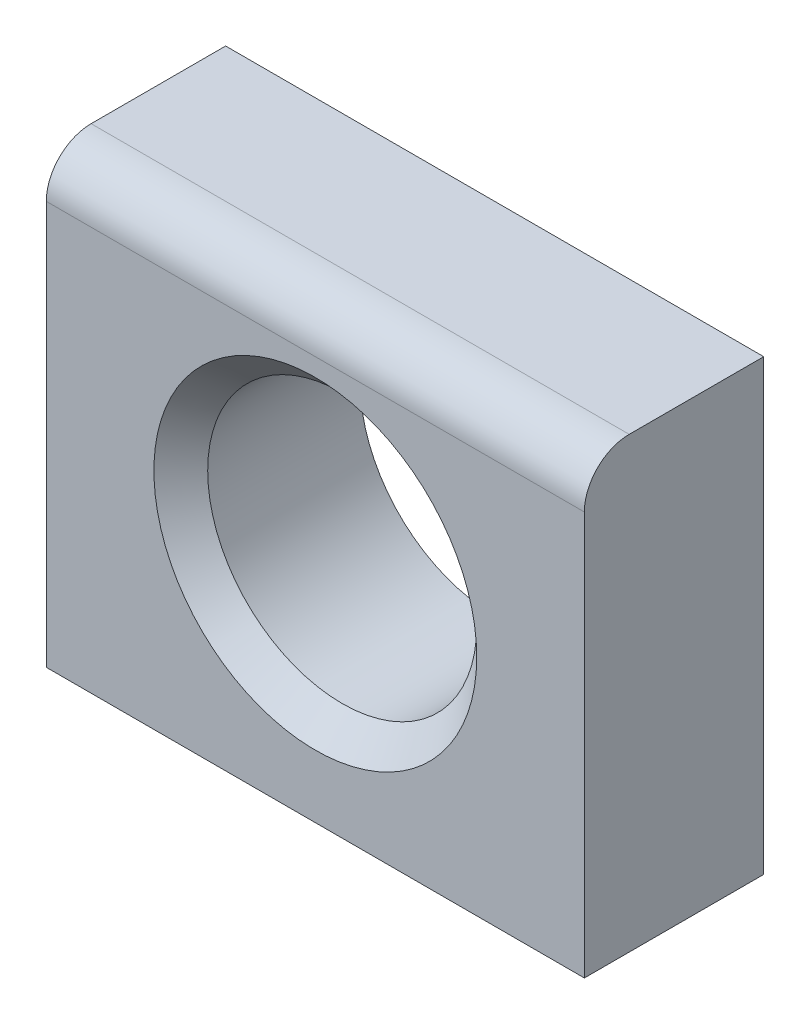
SolidWorks part; units mm, degrees
ref_plane "Płaszczyzna przednia" through (0, 0, 0) normal (0, 0, 1) x (1, 0, 0)
ref_plane "Płaszczyzna górna" through (0, 0, 0) normal (0, 1, 0) x (1, 0, 0)
ref_plane "Płaszczyzna prawa" through (0, 0, 0) normal (1, 0, 0) x (0, 0, -1)
sketch "Szkic1" plane through (0, 0, 0) normal (0, 0, 1) x (1, 0, 0)
  line L1 (30, -25) -> (-30, -25)
  line L2 (30, -25) -> (30, 25)
  line L3 (30, 25) -> (-30, 25)
  line L4 (-30, -25) -> (-30, 25)
  line L5 (30, -25) -> (-30, 25) construction
  line L6 (30, 25) -> (-30, -25) construction
  point P0 (0, 0)
  dimension "D1" = 50
  dimension "D2" = 60
extrude "Dodanie-wyciągnięcie1" add sketch "Szkic1" along normal blind 20
sketch "Szkic otworu" plane through (0, 0, 20) normal (0, 0, 1) x (1, 0, 0)
  circle A0 centre (0, 0) radius 15
  dimension "D1" = 30
extrude "Otwór" cut sketch "Szkic otworu" against normal through all
chamfer "Sfazowanie1" distance 3 angle 45 1 edges at (15, 0, 20)
fillet "Zaokrąglenie1" radius 5 1 edges at (0, 25, 20)
